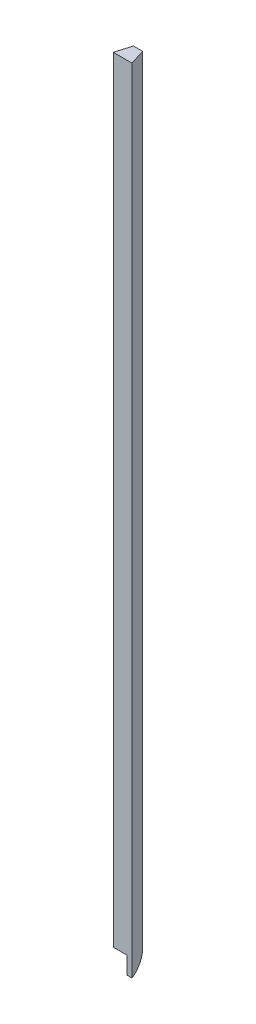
SolidWorks part; units mm, degrees
ref_plane "Front Plane" through (0, 0, 0) normal (0, 0, 1) x (1, 0, 0)
ref_plane "Top Plane" through (0, 0, 0) normal (0, 1, 0) x (1, 0, 0)
ref_plane "Right Plane" through (0, 0, 0) normal (1, 0, 0) x (0, 0, -1)
sketch "Sketch1" plane through (0, 0, 0) normal (0, 1, 0) x (1, 0, 0)
  line L0 (-7.62, 0) -> (7.62, 0)
  line L1 (7.62, 0) -> (3.81, 12.7)
  line L2 (3.81, 12.7) -> (-3.81, 12.7)
  line L3 (-3.81, 12.7) -> (-7.62, 0)
  dimension "D1" = 12.7
  dimension "D2" = 15.24
  dimension "D3" = 7.62
  dimension "D4" = 3.81
  dimension "D5" = 7.62
extrude "Boss-Extrude1" add sketch "Sketch1" along normal blind 635
sketch "Sketch2" plane through (0, 0, 0) normal (0, -1, 0) x (1, 0, 0)
  line L0 (3.81, 0) -> (3.81, -12.7)
  line L1 (7.62, 0) -> (3.81, 0)
  line L5 (7.62, 0) -> (3.81, -12.7)
  dimension "D1" = 3.81
extrude "Boss-Extrude2" add sketch "Sketch2" along normal blind 14.224
sketch "Sketch3" plane through (3.81, 0, 0) normal (-1, 0, 0) x (0, 0, 1)
  line L0 (-12.7, -1.524) -> (-12.7, -14.224)
  line L1 (-12.7, -14.224) -> (0, -14.224)
  arc A0 (-12.7, -1.524) -> (0, -14.224) centre (0.762, -0.762) ccw
extrude "Cut-Extrude1" cut sketch "Sketch3" against normal through all
